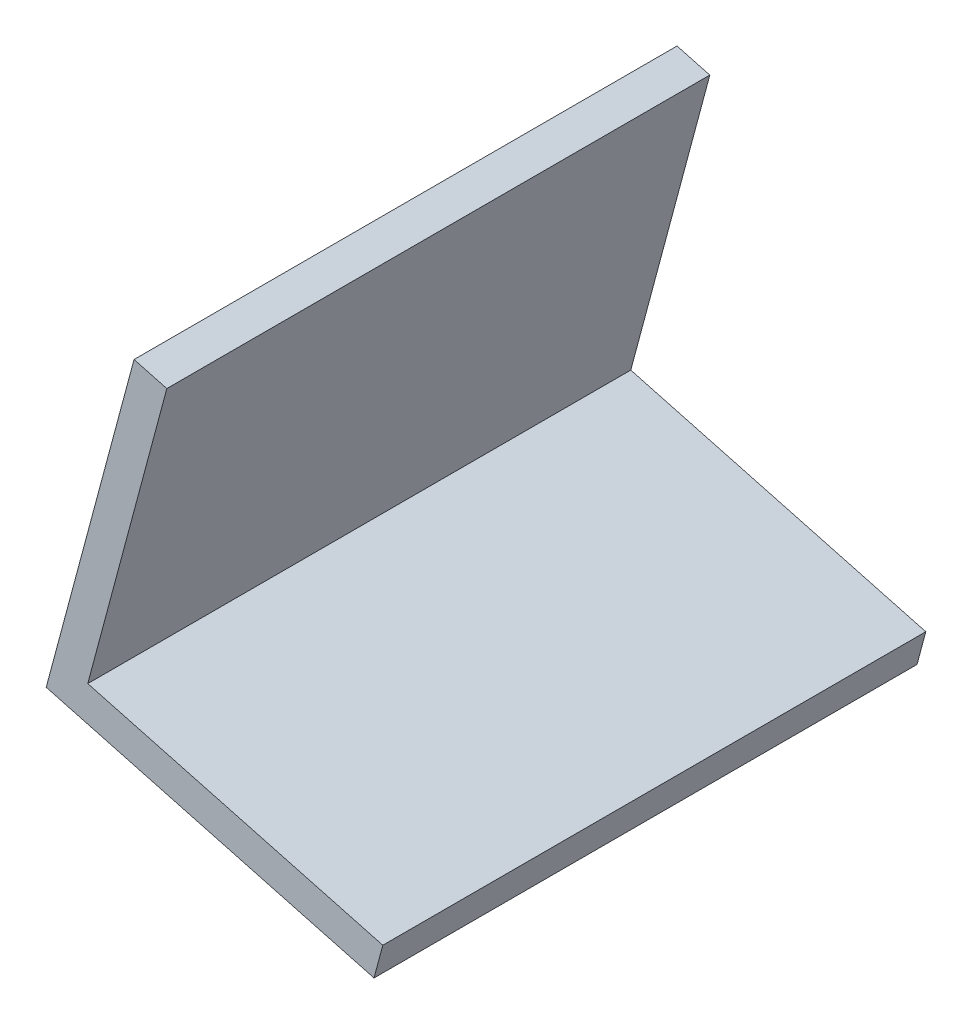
SolidWorks part; units mm, degrees
ref_plane "Face" through (0, 0, 0) normal (0, 0, 1) x (1, 0, 0)
ref_plane "Dessus" through (0, 0, 0) normal (0, 1, 0) x (1, 0, 0)
ref_plane "Droite" through (0, 0, 0) normal (1, 0, 0) x (0, 0, -1)
sketch "Esquisse1" plane through (0, 0, 0) normal (0, 0, 1) x (1, 0, 0)
  line L0 (2512.8219, 3834.7029) -> (2517.6516, 3833.4088)
  line L1 (2517.6516, 3833.4088) -> (2506.0047, 3789.9421)
  line L2 (2506.0047, 3789.9421) -> (2549.4714, 3778.2953)
  line L3 (2549.4714, 3778.2953) -> (2548.1773, 3773.4657)
  line L4 (2548.1773, 3773.4657) -> (2499.881, 3786.4066)
  line L5 (2499.881, 3786.4066) -> (2512.8219, 3834.7029)
extrude "Base-Extrusion" add sketch "Esquisse1" against normal blind 80
